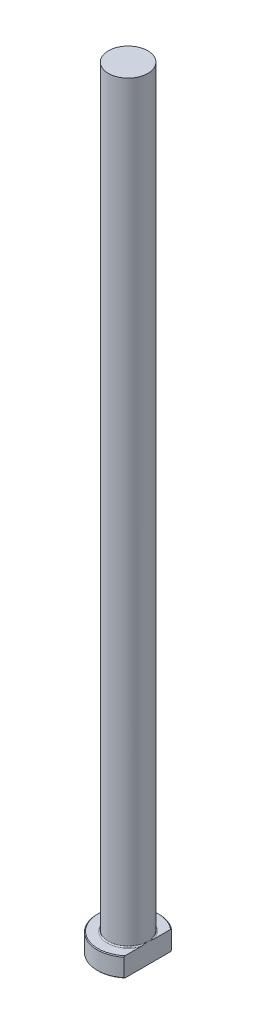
SolidWorks part; units mm, degrees
ref_plane "Front Plane" through (0, 0, 0) normal (0, 0, 1) x (1, 0, 0)
ref_plane "Top Plane" through (0, 0, 0) normal (0, 1, 0) x (1, 0, 0)
ref_plane "Right Plane" through (0, 0, 0) normal (1, 0, 0) x (0, 0, -1)
sketch "Sketch1" plane through (0, 0, 0) normal (0, 0, 1) x (1, 0, 0)
  line L0 (0, 259.9588) -> (0, -15.1925) construction
  line L1 (0, 0) -> (-8, 0)
  line L2 (-8, 0) -> (-8, 5)
  line L3 (-8, 5) -> (-5.1, 5)
  line L4 (-5.1, 5) -> (-5.1, 200)
  line L5 (-5.1, 200) -> (0, 200)
  line L6 (0, 200) -> (0, 0)
  dimension "L" = 200
  dimension "H" = 16
  dimension "T" = 5
  dimension "D" = 10.2
revolve "Revolve1" add sketch "Sketch1" angle 360 about L0
chamfer "Chamfer1" distance 0.2 angle 45 2 edges at (0, 5, 8) (0, 0, 8)
fillet "Fillet1" radius 0.3 1 edges at (0, 5, 5.1)
sketch "Sketch2" plane through (0, 0, 0) normal (0, 1, 0) x (1, 0, 0)
  line L0 (5.1, 6.1636) -> (5.1, -6.1636)
  circle A0 centre (0, 0) radius 8 construction
  arc A1 (5.1, -6.1636) -> (5.1, 6.1636) centre (0, 0) ccw
  circle A2 centre (0, 0) radius 5.1 construction
extrude "KEY" cut sketch "Sketch2" along normal through all
